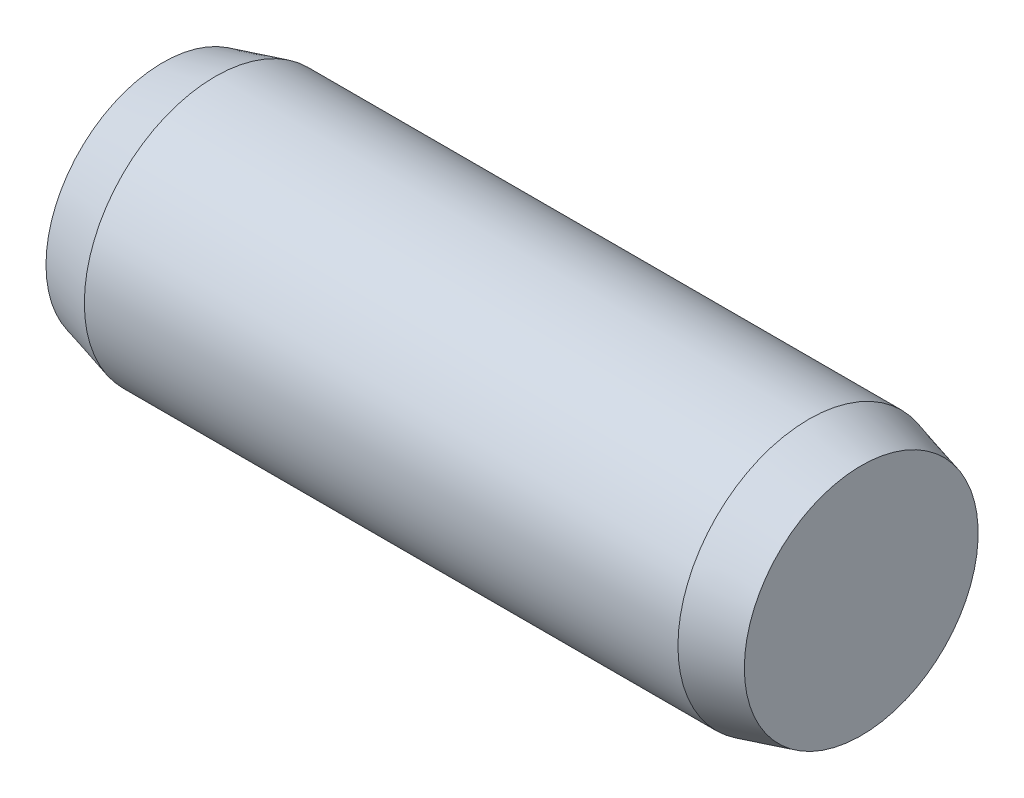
SolidWorks part; units mm, degrees
ref_plane "Plane1" through (0, 0, 0) normal (0, 0, 1) x (1, 0, 0)
ref_plane "Plane2" through (0, 0, 0) normal (0, 1, 0) x (1, 0, 0)
ref_plane "Plane3" through (0, 0, 0) normal (1, 0, 0) x (0, 0, -1)
revolve "Base-Revolve" add sketch "Sketch1" angle 360 about L1
sketch "Sketch1" plane through (0, 0, 0) normal (0, 0, 1) x (1, 0, 0)
  line L1 (-6.35, 0) -> (107.95, 0) construction
  line L2 (0, 0) -> (4, 0)
  line L3 (4, 0) -> (4, 0.6696)
  line L4 (4, 0.6696) -> (3.7, 0.75)
  line L5 (3.7, 0.75) -> (0.3, 0.75)
  line L6 (0, 0.6696) -> (0, 0)
  line L7 (0, 0.6696) -> (0.3, 0.75)
  dimension "D1" = 0.3
  dimension "D2" = 15
  dimension "D3" = 15
  dimension "Diameter" = 1.5
  dimension "Length" = 4
  dimension "Chamfer_len" = 0.3
equation "\"D3@Sketch1\" = 15.0"
equation "\"D1@Sketch1\" = \"Chamfer_len@Sketch1\""
equation "\"D2@Sketch1\" = \"D3@Sketch1\""
